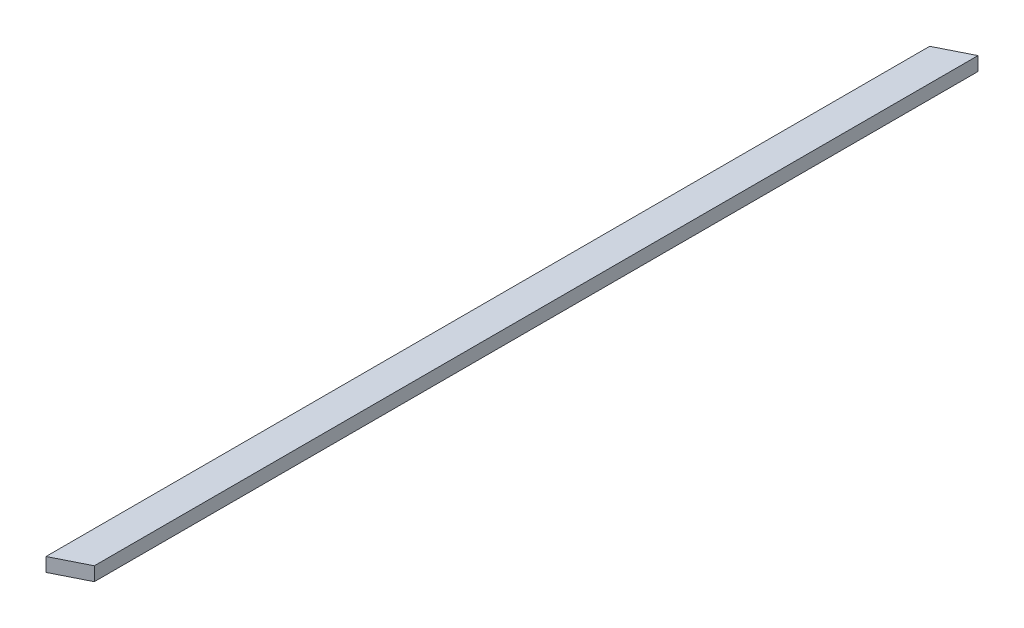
SolidWorks part; units mm, degrees
ref_plane "Front Plane" through (0, 0, 0) normal (0, 0, 1) x (1, 0, 0)
ref_plane "Top Plane" through (0, 0, 0) normal (0, 1, 0) x (1, 0, 0)
ref_plane "Right Plane" through (0, 0, 0) normal (1, 0, 0) x (0, 0, -1)
sketch "Sketch1" plane through (0, 0, 0) normal (0, 1, 0) x (1, 0, 0)
  line L0 (0, 0) -> (0, -2438.4)
  line L1 (0, -2438.4) -> (-88.9, -2482.8596)
  line L2 (-88.9, -2482.8596) -> (-88.9, -44.4596)
  line L3 (-88.9, -44.4596) -> (0, 0)
  line L4 (0, 0) -> (-224.0699, 0) construction
  dimension "D1" = 2438.4
  dimension "D2" = 26.57
  dimension "D3" = 88.9
extrude "Boss-Extrude1" add sketch "Sketch1" along normal blind 38.1
